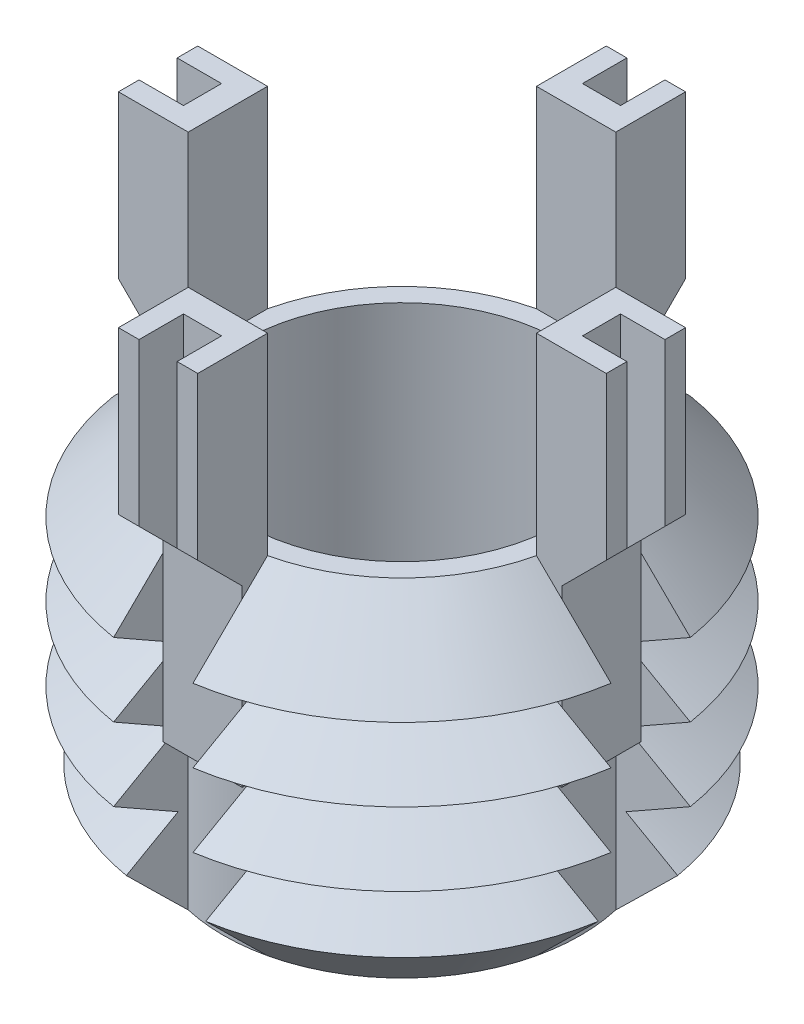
SolidWorks part; units mm, degrees
ref_plane "Front Plane" through (0, 0, 0) normal (0, 0, 1) x (1, 0, 0)
ref_plane "Top Plane" through (0, 0, 0) normal (0, 1, 0) x (1, 0, 0)
ref_plane "Right Plane" through (0, 0, 0) normal (1, 0, 0) x (0, 0, -1)
sketch "Sketch1" plane through (0, 0, 0) normal (0, 1, 0) x (1, 0, 0)
  circle A0 centre (0, 0) radius 7.9375
  dimension "D1" = 15.875
extrude "Boss-Extrude1" add sketch "Sketch1" against normal blind 10.922
chamfer "Chamfer1" distance 2.309 angle 45 2 edges at (0, -10.922, 7.9375) (0, 0, 7.9375)
sketch "Sketch2" plane through (0, 0, 0) normal (1, 0, 0) x (0, 0, -1)
  line L0 (0, 0.8859) -> (0, -9.2617) construction
sketch "Sketch3" plane through (0, 0, 0) normal (1, 0, 0) x (0, 0, -1)
  line L0 (-7.9375, -2.309) -> (-5.9378, -3.4635)
  line L1 (-5.9378, -3.4635) -> (-7.9375, -4.618)
  line L2 (-7.9375, -2.309) -> (-7.9375, -8.613) construction
  line L3 (-7.9375, -4.618) -> (-7.9375, -2.309)
  dimension "D1" = 2.309
revolve "Cut-Revolve1" cut sketch "Sketch3" angle 360 about L0
pattern_linear "LPattern1" count 3 spacing 2.309 along (0, -1, 0) of "Cut-Revolve1"
sketch "Sketch4" plane through (0, 0, 0) normal (0, 1, 0) x (1, 0, 0)
  line L0 (-5.4879, 1.25) -> (-7.8385, 1.25)
  line L2 (-7.8385, -1.25) -> (-5.4879, -1.25)
  arc A0 (-5.4879, 1.25) -> (-5.4879, -1.25) centre (0, 0) ccw
  arc A1 (-7.8385, 1.25) -> (-7.8385, -1.25) centre (0, 0) ccw
  circle A2 centre (0, 0) radius 7.9375 construction
  circle A3 centre (0, 0) radius 5.6285 construction
  point P1 (-5.6285, 0)
  point P3 (-7.9375, 0)
  point P13 (0, 0)
  dimension "D1" = 2.5
extrude "Cut-Extrude1" cut sketch "Sketch4" against normal up to surface (10.922 mm away)
pattern_circular "CirPattern1" count 4 over 360 about axis through (0, 0, 0) along (0, 1, 0) of "Cut-Extrude1"
sketch "Sketch5" plane through (0, 0, 0) normal (1, 0, 0) x (0, 0, -1)
  line L0 (-5.4879, 6.073) -> (-5.4879, -5.927)
  line L1 (-5.4879, -5.927) -> (-6.2879, -5.927)
  line L2 (-6.2879, -5.927) -> (-6.2879, -0.427)
  line L3 (-6.2879, -0.427) -> (-7.6879, 0.973)
  line L4 (-7.6879, 0.973) -> (-7.6879, 6.073)
  line L5 (-7.6879, 6.073) -> (-5.4879, 6.073)
  line L6 (-7.8385, -6.927) -> (-1.25, -6.927) construction
  point P9 (-1.25, 0)
  point P10 (-6.2879, -0.427)
  dimension "D1" = 1
  dimension "D2" = 12
  dimension "D3" = 6.5
  dimension "D4" = 2.2
  dimension "D5" = 0.8
  dimension "D6" = 45
extrude "Boss-Extrude3" add sketch "Sketch5" along normal mid plane 2.5
pattern_circular "CirPattern2" count 4 over 360 about axis through (0, 0, 0) along (0, 1, 0) of "Boss-Extrude3"
sketch "Sketch6" plane through (0, 6.073, 0) normal (0, 1, 0) x (1, 0, 0)
  line L0 (-7.6879, -1.25) -> (-7.6879, 1.25) construction
  line L1 (-7.6879, -0.6) -> (-6.2879, -0.6)
  line L2 (-7.6879, -0.6) -> (-7.6879, 0.6)
  line L3 (-7.6879, 0.6) -> (-6.2879, 0.6)
  line L4 (-6.2879, -0.6) -> (-6.2879, 0.6)
  line L5 (-7.6879, -0.6) -> (-6.2879, 0.6) construction
  line L6 (-7.6879, 0.6) -> (-6.2879, -0.6) construction
  line L7 (7.6879, 1.25) -> (7.6879, -1.25) construction
  line L8 (-0.6, 6.2879) -> (0.6, 6.2879)
  line L9 (-0.6, 6.2879) -> (-0.6, 7.6879)
  line L10 (-0.6, 7.6879) -> (0.6, 7.6879)
  line L11 (0.6, 6.2879) -> (0.6, 7.6879)
  line L12 (-0.6, 6.2879) -> (0.6, 7.6879) construction
  line L13 (-0.6, 7.6879) -> (0.6, 6.2879) construction
  line L14 (6.2879, -0.6) -> (7.6879, -0.6)
  line L15 (6.2879, -0.6) -> (6.2879, 0.6)
  line L16 (6.2879, 0.6) -> (7.6879, 0.6)
  line L17 (7.6879, -0.6) -> (7.6879, 0.6)
  line L18 (6.2879, -0.6) -> (7.6879, 0.6) construction
  line L19 (6.2879, 0.6) -> (7.6879, -0.6) construction
  line L20 (-0.6, -7.6879) -> (0.6, -7.6879)
  line L21 (-0.6, -7.6879) -> (-0.6, -6.2879)
  line L22 (-0.6, -6.2879) -> (0.6, -6.2879)
  line L23 (0.6, -7.6879) -> (0.6, -6.2879)
  line L24 (-0.6, -7.6879) -> (0.6, -6.2879) construction
  line L25 (-0.6, -6.2879) -> (0.6, -7.6879) construction
  line L26 (-1.25, 7.6879) -> (1.25, 7.6879) construction
  line L27 (1.25, -7.6879) -> (-1.25, -7.6879) construction
  point P0 (-6.9879, 0)
  point P7 (-7.6879, 0)
  point P8 (-7.6879, 0)
  point P9 (0, 6.9879)
  point P14 (6.9879, 0)
  point P19 (0, -6.9879)
  point P24 (0, 7.6879)
  point P25 (7.6879, 0)
  point P26 (7.6879, 0)
  point P27 (0, 7.6879)
  point P30 (0, -7.6879)
  point P33 (0, -7.6879)
  dimension "D1" = 1.2
  dimension "D2" = 1.4
extrude "Cut-Extrude3" cut sketch "Sketch6" against normal up to surface (5.1 mm away)
sketch "Sketch7" plane through (0, 0, 0) normal (0, 1, 0) x (1, 0, 0)
  circle A0 centre (0, 0) radius 5
  dimension "D1" = 10
extrude "Cut-Extrude4" cut sketch "Sketch7" against normal up to surface (10.922 mm away)
